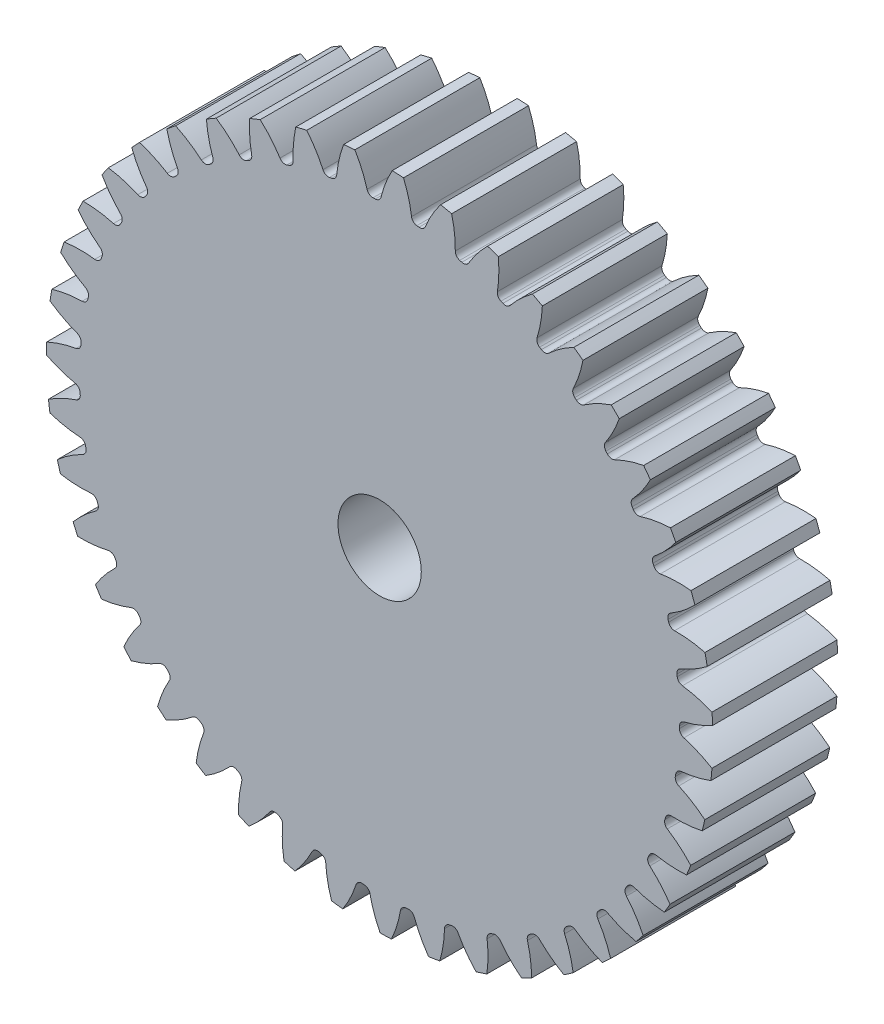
SolidWorks part; units mm, degrees
ref_plane "Front" through (0, 0, 0) normal (0, 0, 1) x (1, 0, 0)
ref_plane "Top" through (0, 0, 0) normal (0, 1, 0) x (1, 0, 0)
ref_plane "Right" through (0, 0, 0) normal (1, 0, 0) x (0, 0, -1)
sketch "Sketch3" plane through (0, 0, 0) normal (0, 0, 1) x (1, 0, 0)
  circle A0 centre (0, 0) radius 254
  dimension "od" = 508
extrude "gearBody" add sketch "Sketch3" along normal blind 95.25
sketch "Sketch2" plane through (0, 0, 0) normal (0, 0, 1) x (1, 0, 0)
  line L0 (0, 0) -> (210.7128, 87.2801) construction
  line L1 (253.4771, -18.9716) -> (0, 0) construction
  line L2 (0, 0) -> (36.3143, 0) construction
  line L3 (242.671, 4.4111) -> (242.3492, -13.2486) construction
  line L5 (242.5101, -4.4188) -> (0, 0) construction
  line L7 (0, 0) -> (228.0738, 0) construction
  arc A0 (228.0738, 0.1755) -> (227.916, -8.4842) centre (0, 0) ccw construction
  arc A1 (253.8176, 9.6233) -> (253.2986, -18.8635) centre (0, 0) ccw construction
  arc A2 (242.671, 4.4111) -> (242.3492, -13.2486) centre (0, 0) ccw construction
  arc A3 (228.5452, -5.0034) -> (228.5758, -3.3258) centre (0, 0) ccw
  arc A4 (253.4771, -18.9716) -> (231.8724, -9.5206) centre (207.3933, -94.8984) ccw
  arc A5 (253.4771, -18.9716) -> (254, 9.7248) centre (0, 0) ccw
  arc A6 (254, 9.7248) -> (232.0653, 1.0671) centre (210.7128, 87.2801) cw
  arc A7 (228.5758, -3.3258) -> (232.0653, 1.0671) centre (233.1699, -3.3927) cw
  arc A8 (231.8724, -9.5206) -> (228.5452, -5.0034) centre (233.1387, -5.1039) cw
  point P6 (254, 9.7248)
  point P22 (253.4771, -18.9716)
  dimension "baseDia" = 456.1477
  dimension "od" = 508
  dimension "pd" = 485.4222
  dimension "rd" = 457.2
  dimension "rFillet" = 4.5946
  dimension "pointX" = 254
  dimension "pointY" = 9.7248
  dimension "CTT" = 17.6597
  dimension "flankCenterAngle" = 22.5
extrude "toothCut" cut sketch "Sketch2" along normal through all
pattern_circular "CirPattern1" count 43 over 360 about axis through (0, 0, 0) along (0, 0, 1) of "toothCut"
sketch "hub1Dia" plane through (0, 0, 0) normal (0, 0, -1) x (-1, 0, 0)
  circle A0 centre (0, 0) radius 12.7
  dimension "hub1Dia" = 25.4
sketch "hub2Dia" plane through (0, 0, 95.25) normal (0, 0, 1) x (1, 0, 0)
  circle A0 centre (0, 0) radius 12.7
  dimension "hub2dia" = 25.4
sketch "boreDia" plane through (0, 0, 0) normal (0, 0, 1) x (1, 0, 0)
  circle A0 centre (0, 0) radius 31.75
  dimension "boreDia" = 63.5
extrude "bore" cut sketch "boreDia" against normal mid plane 25400
